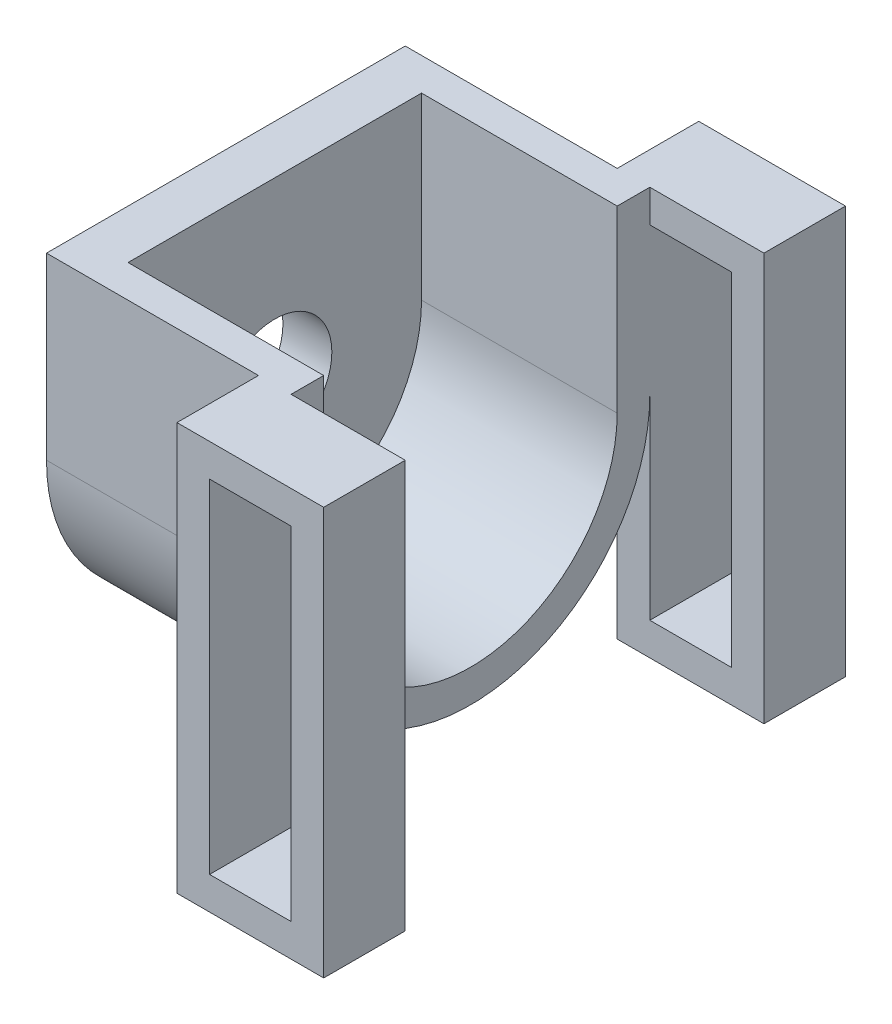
SolidWorks part; units mm, degrees
ref_plane "Front Plane" through (0, 0, 0) normal (0, 0, 1) x (1, 0, 0)
ref_plane "Top Plane" through (0, 0, 0) normal (0, 1, 0) x (1, 0, 0)
ref_plane "Right Plane" through (0, 0, 0) normal (1, 0, 0) x (0, 0, -1)
sketch "Sketch1" plane through (0, 0, 0) normal (1, 0, 0) x (0, 0, -1)
  line L2 (-11, 0) -> (-11, 11)
  line L3 (-11, 11) -> (11, 11)
  line L4 (11, 0) -> (11, 11)
  arc A0 (-11, 0) -> (11, 0) centre (0, 0) ccw
  dimension "D1" = 22
  dimension "D2" = 11
extrude "Boss-Extrude2" add sketch "Sketch1" along normal blind 15
sketch "Sketch2" plane through (15, 0, 0) normal (1, 0, 0) x (0, 0, -1)
  line L0 (11, 11) -> (-11, 11) construction
  line L2 (-9, 0) -> (-9, 11)
  line L3 (-9, 11) -> (9, 11)
  line L4 (9, 0) -> (9, 11)
  arc A0 (-9, 0) -> (9, 0) centre (0, 0) ccw
  dimension "D1" = 18
extrude "Cut-Extrude1" cut sketch "Sketch2" against normal blind 12 contours A0 L4 L3 L2
sketch "Sketch3" plane through (3, 0, 0) normal (1, 0, 0) x (0, 0, -1)
  circle A0 centre (0, 0) radius 3.5
  dimension "D1" = 7
extrude "Cut-Extrude2" cut sketch "Sketch3" against normal through all contours A0
sketch "Sketch4" plane through (0, 0, -11) normal (0, 0, -1) x (-1, 0, 0)
  line L0 (-15, 0) -> (0, 0) construction
  line L1 (-15, 11) -> (-13, 11)
  line L2 (-15, 11) -> (-15, 0)
  line L3 (-15, 0) -> (-13, 0)
  line L4 (-13, 11) -> (-13, 0)
  dimension "D1" = 2
extrude "Boss-Extrude3" add sketch "Sketch4" along normal blind 5 contours L2 L1 L4 L3
sketch "Sketch6" plane through (0, 0, 0) normal (0, -1, 0) x (1, 0, 0)
  line L1 (13, -11) -> (15, -11)
  line L2 (13, -11) -> (13, -16)
  line L3 (13, -16) -> (15, -16)
  line L4 (15, -11) -> (15, -16)
extrude "Boss-Extrude4" add sketch "Sketch6" along normal blind 14 contours L2 L1 L4 L3
sketch "Sketch7" plane through (15, 0, 0) normal (1, 0, 0) x (0, 0, -1)
  line L1 (11, -14) -> (16, -14)
  line L2 (11, -14) -> (11, 11)
  line L3 (11, 11) -> (16, 11)
  line L4 (16, -14) -> (16, 11)
extrude "Boss-Extrude5" add sketch "Sketch7" along normal blind 7 contours L2 L1 L4 L3
sketch "Sketch8" plane through (0, 0, 11) normal (0, 0, 1) x (1, 0, 0)
  line L0 (15, 0) -> (0, 0) construction
  line L1 (15, 11) -> (13, 11)
  line L2 (15, 11) -> (15, 0)
  line L3 (15, 0) -> (13, 0)
  line L4 (13, 11) -> (13, 0)
  dimension "D1" = 2
extrude "Boss-Extrude6" add sketch "Sketch8" along normal blind 5 contours L2 L1 L4 L3
sketch "Sketch9" plane through (0, 0, 0) normal (0, -1, 0) x (1, 0, 0)
  line L1 (13, 16) -> (15, 16)
  line L2 (13, 16) -> (13, 11)
  line L3 (13, 11) -> (15, 11)
  line L4 (15, 16) -> (15, 11)
extrude "Boss-Extrude7" add sketch "Sketch9" along normal blind 14 contours L2 L1 L4 L3
sketch "Sketch10" plane through (15, 0, 0) normal (1, 0, 0) x (0, 0, -1)
  line L1 (-11, -14) -> (-16, -14)
  line L2 (-11, -14) -> (-11, 11)
  line L3 (-11, 11) -> (-16, 11)
  line L4 (-16, -14) -> (-16, 11)
extrude "Boss-Extrude8" add sketch "Sketch10" along normal blind 7 contours L2 L1 L4 L3
sketch "Sketch11" plane through (0, 0, 16) normal (0, 0, 1) x (1, 0, 0)
  line L0 (13, 11) -> (13, -14) construction
  line L1 (15, 9) -> (20, 9)
  line L2 (15, 9) -> (15, -12)
  line L3 (15, -12) -> (20, -12)
  line L4 (20, 9) -> (20, -12)
  line L5 (22, -14) -> (22, 11) construction
  line L6 (22, 11) -> (13, 11) construction
  line L7 (13, -14) -> (22, -14) construction
  dimension "D1" = 2
  dimension "D2" = 2
  dimension "D3" = 2
  dimension "D4" = 2
extrude "Cut-Extrude3" cut sketch "Sketch11" against normal through all contours L2 L1 L4 L3
